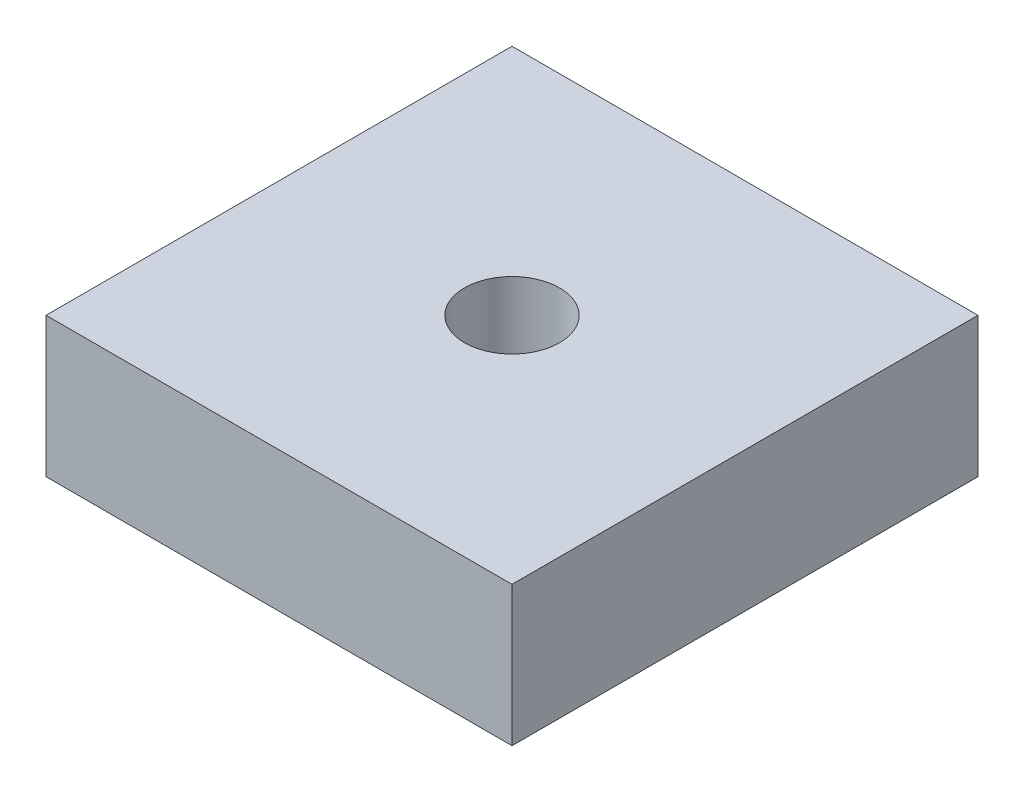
SolidWorks part; units mm, degrees
ref_plane "Plan de face" through (0, 0, 0) normal (0, 0, 1) x (1, 0, 0)
ref_plane "Plan de dessus" through (0, 0, 0) normal (0, 1, 0) x (1, 0, 0)
ref_plane "Plan de droite" through (0, 0, 0) normal (1, 0, 0) x (0, 0, -1)
sketch "Esquisse1" plane through (0, 0, 0) normal (0, 1, 0) x (1, 0, 0)
  line L1 (-25, -25) -> (25, -25)
  line L2 (-25, -25) -> (-25, 25)
  line L3 (-25, 25) -> (25, 25)
  line L4 (25, -25) -> (25, 25)
  point P4 (0, 25)
  point P6 (-25, 0)
  dimension "D1" = 50
extrude "Extrusion1" add sketch "Esquisse1" along normal blind 15
hole_wizard "Trou taraudé M121" positions "Esquisse3" profile "Esquisse2" tap size "M12" standard "ISO"
sketch "Esquisse3" plane through (0, 15, 0) normal (0, 1, 0) x (-1, 0, 0)
  point P0 (0, 0)
sketch "Esquisse2" plane through (0, 15, 0) normal (1, 0, 0) x (0, 0, 1)
  line L0 (0, 0) -> (0, 15)
  line L1 (0, 15) -> (5.1, 15)
  line L2 (5.1, 15) -> (5.1, 0)
  line L5 (5.1, 0) -> (0, 0)
  line L11 (0, -6.35) -> (0, 107.95) construction
  dimension "Diamètre du trou pour taraudage jusqu'au prochain" = 10.2
  dimension "Profondeur du trou pour taraudage jusqu'au prochain" = 15
